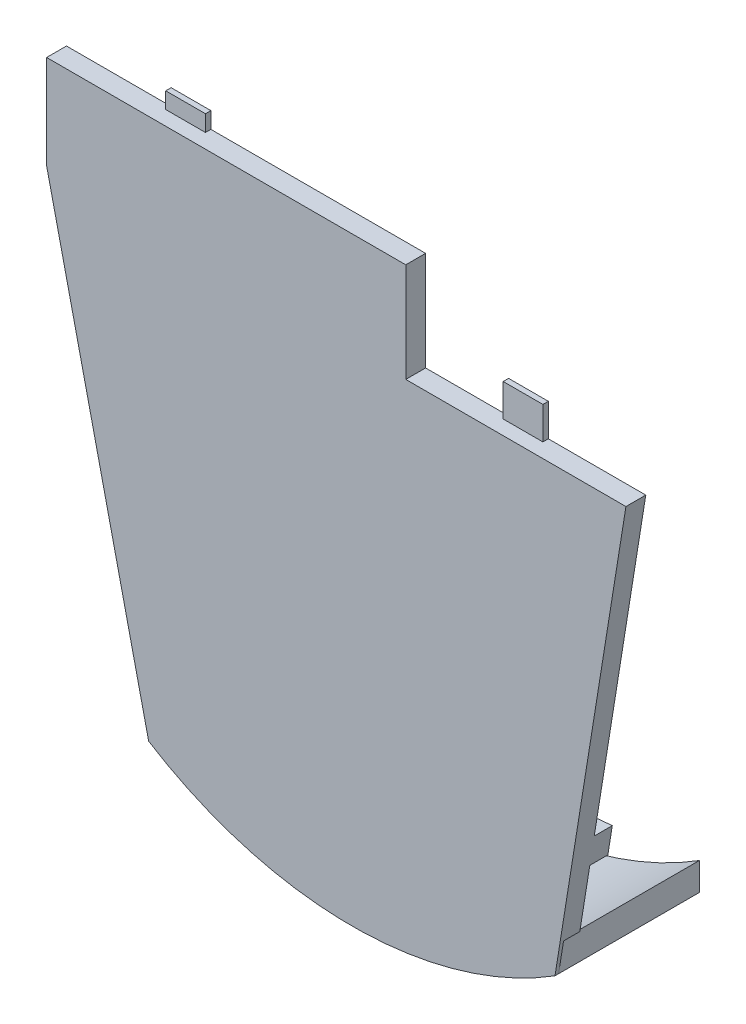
SolidWorks part; units mm, degrees
ref_plane "Front Plane" through (0, 0, 0) normal (0, 0, 1) x (1, 0, 0)
ref_plane "Top Plane" through (0, 0, 0) normal (0, 1, 0) x (1, 0, 0)
ref_plane "Right Plane" through (0, 0, 0) normal (1, 0, 0) x (0, 0, -1)
sketch "Sketch1" plane through (0, 0, 0) normal (0, 0, 1) x (1, 0, 0)
  line L0 (-37.8954, 2.54) -> (19.2928, 2.54) construction
  line L1 (-37.8954, 2.54) -> (-52.2568, 65.4977)
  line L2 (-52.2568, 65.4977) -> (-52.2568, 78.7057)
  line L3 (-52.2568, 78.7057) -> (-1.7108, 78.7057)
  line L4 (-1.7108, 78.7057) -> (-1.7108, 64.7357)
  line L5 (-1.7108, 64.7357) -> (29.2772, 64.7357)
  line L8 (29.2772, 64.7357) -> (19.2928, 2.54)
  arc A0 (-37.8954, 2.54) -> (19.2928, 2.54) centre (-9.3013, 48.1688) ccw
  point P2 (-9.3013, 2.54)
  point P4 (-9.3013, -5.6792)
  dimension "D7" = 53.848
  dimension "D2" = 62.992
  dimension "D3" = 13.208
  dimension "D4" = 13.97
  dimension "D5" = 30.988
  dimension "D6" = 50.546
  dimension "D8" = 102.85
  dimension "D9" = 2.54
  dimension "D10" = 9.3013
  dimension "D11" = 99.12
extrude "Boss-Extrude1" add sketch "Sketch1" along normal blind 20.32
sketch "Sketch5" plane through (0, 0, 0) normal (0, 0, -1) x (-1, 0, 0)
  line L0 (-29.2772, 64.7357) -> (1.7108, 64.7357)
  line L1 (1.7108, 64.7357) -> (1.7108, 78.7057)
  line L2 (1.7108, 78.7057) -> (52.2568, 78.7057)
  line L3 (52.2568, 78.7057) -> (52.2568, 65.4977)
  line L4 (52.2568, 65.4977) -> (38.8871, 6.8876)
  line L5 (52.2568, 65.4977) -> (37.8954, 2.54) construction
  line L6 (-29.2772, 64.7357) -> (-19.9907, 6.8876)
  line L7 (-19.2928, 2.54) -> (-29.2772, 64.7357) construction
  arc A0 (-19.9907, 6.8876) -> (38.8871, 6.8876) centre (9.4482, 51.9759) ccw
  arc A3 (-19.2928, 2.54) -> (37.8954, 2.54) centre (9.3013, 48.1688) ccw construction
  point P22 (9.4482, -1.8721)
  point P23 (9.3013, -5.6792)
  dimension "D1" = 53.848
  dimension "D2" = 3.81
extrude "Cut-Extrude2" cut sketch "Sketch5" against normal blind 17.526
sketch "Sketch10" plane through (0, 0, 17.526) normal (0, 0, -1) x (-1, 0, 0)
  line L0 (52.2568, 78.7057) -> (1.7108, 78.7057) construction
  line L1 (31.9368, 78.7057) -> (37.5248, 78.7057)
  line L2 (31.9368, 78.7057) -> (31.9368, 80.9917)
  line L3 (31.9368, 80.9917) -> (37.5248, 80.9917)
  line L4 (37.5248, 78.7057) -> (37.5248, 80.9917)
  line L5 (1.7108, 64.7357) -> (-29.2772, 64.7357) construction
  line L6 (-15.5612, 64.7357) -> (-9.9732, 64.7357)
  line L7 (-15.5612, 64.7357) -> (-15.5612, 69.3077)
  line L8 (-15.5612, 69.3077) -> (-9.9732, 69.3077)
  line L9 (-9.9732, 64.7357) -> (-9.9732, 69.3077)
  line L10 (1.7108, 78.7057) -> (1.7108, 64.7357) construction
  dimension "D1" = 5.588
  dimension "D2" = 5.588
  dimension "D3" = 4.572
  dimension "D4" = 2.286
  dimension "D5" = 30.226
  dimension "D6" = 11.684
extrude "Boss-Extrude5" add sketch "Sketch10" against normal blind 0.762
sketch "Sketch12" plane through (0, 0, 0) normal (0, 0, -1) x (-1, 0, 0)
  line L0 (-19.2928, 2.54) -> (-19.2928, 6.4825)
  line L1 (-19.2928, 6.4825) -> (-19.9907, 6.8876)
  line L2 (-19.9907, 6.8876) -> (-19.2928, 2.54)
  line L3 (37.8954, 2.54) -> (37.8954, 6.2554)
  line L5 (38.8871, 6.8876) -> (37.8954, 2.54)
  line L7 (37.8954, 6.2554) -> (38.8871, 6.8876)
  arc A0 (-19.9907, 6.8876) -> (38.8871, 6.8876) centre (9.4482, 51.9759) ccw construction
  dimension "D1" = 1.1761
  dimension "D2" = 0.807
extrude "Cut-Extrude4" cut sketch "Sketch12" against normal blind 19.812
sketch "Sketch19" plane through (0, 0, 17.526) normal (0, 0, -1) x (-1, 0, 0)
  line L0 (41.6551, 19.0219) -> (40.7795, 15.1835)
  line L1 (38.8871, 6.8876) -> (52.2568, 65.4977) construction
  line L2 (40.7795, 15.1835) -> (38.3414, 15.9093)
  line L3 (38.3414, 15.9093) -> (39.1605, 19.5)
  line L4 (39.1605, 19.5) -> (41.6551, 19.0219)
  point P4 (43.1528, 37.5134)
  point P7 (42.7899, 36.8242)
  point P8 (42.6746, 36.9908)
  dimension "D1" = 2.54
  dimension "D2" = 3.937
  dimension "D3" = 3.683
  dimension "D4" = 8.509
  dimension "D5" = 88
extrude "Boss-Extrude6" add sketch "Sketch19" along normal blind 2.54 contours L3 L4 L0 L2
sketch "Sketch20" plane through (0, 0, 17.526) normal (0, 0, -1) x (-1, 0, 0)
  line L0 (-22.0238, 19.5525) -> (-19.495, 19.3152)
  line L1 (-29.2772, 64.7357) -> (-19.9907, 6.8876) construction
  line L2 (-19.495, 19.3152) -> (-18.9421, 16.0598)
  line L3 (-18.9421, 16.0598) -> (-21.3998, 15.6652)
  line L4 (-21.3998, 15.6652) -> (-22.0238, 19.5525)
  dimension "D1" = 3.937
  dimension "D2" = 2.54
  dimension "D3" = 3.302
  dimension "D4" = 8.89
  dimension "D5" = 90
  dimension "D6" = 105
extrude "Boss-Extrude7" add sketch "Sketch20" along normal blind 2.54
